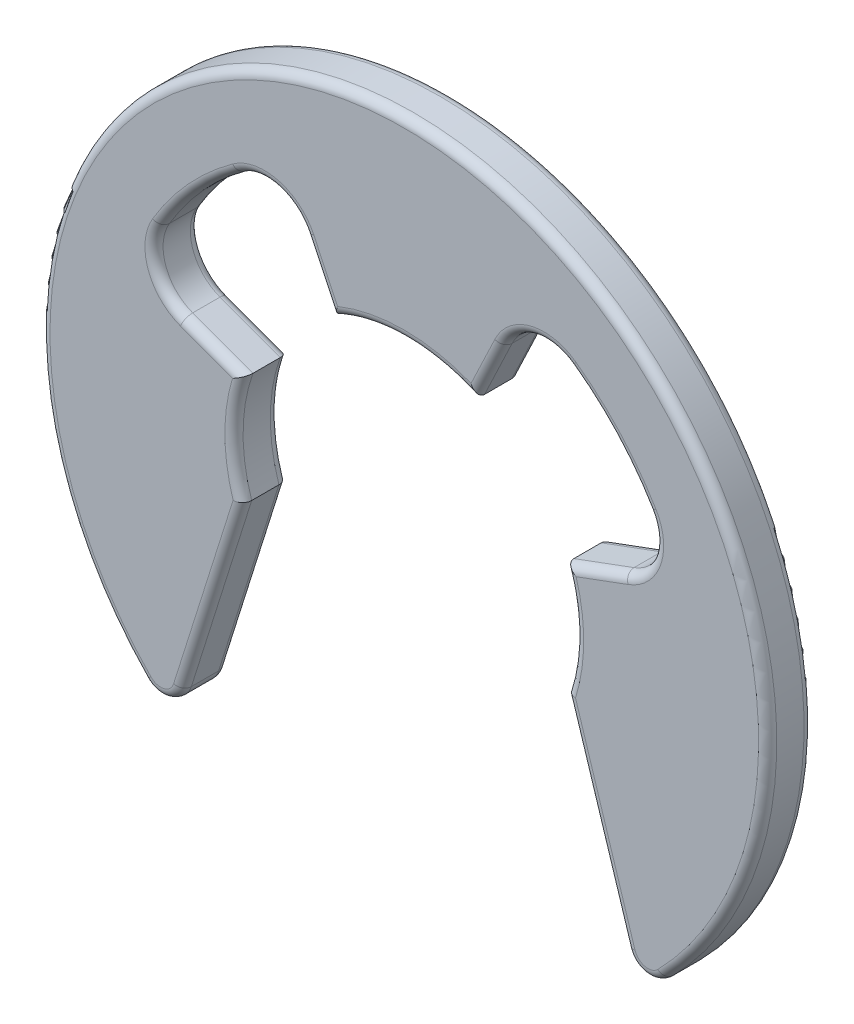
SolidWorks part; units mm, degrees
ref_plane "Face" through (0, 0, 0) normal (0, 0, 1) x (1, 0, 0)
ref_plane "Dessus" through (0, 0, 0) normal (0, 1, 0) x (1, 0, 0)
ref_plane "Droite" through (0, 0, 0) normal (1, 0, 0) x (0, 0, -1)
sketch "Esquisse1" plane through (0, 0, 0) normal (0, 0, 1) x (1, 0, 0)
  line L0 (0, 32.9901) -> (0, -36.8943) construction
  line L1 (1.5673, 3.4068) -> (2.1733, 4.683)
  line L2 (3.5324, 1.2588) -> (4.8573, 1.7492)
  line L3 (3.5596, -1.1798) -> (4.8875, -5.3919)
  line L4 (-3.5596, -1.1798) -> (-4.8875, -5.3919)
  line L5 (-3.5324, 1.2588) -> (-4.8573, 1.7492)
  line L6 (-1.5673, 3.4068) -> (-2.1733, 4.683)
  arc A0 (5.722, -5.591) -> (-5.722, -5.591) centre (0, 0) ccw
  arc A1 (3.5596, -1.1798) -> (3.5324, 1.2588) centre (0, 0) ccw
  arc A2 (5.3693, 3.1988) -> (3.6627, 5.0643) centre (0, 0) ccw
  arc A3 (1.5673, 3.4068) -> (-1.5673, 3.4068) centre (0, 0) ccw
  arc A4 (2.1733, 4.683) -> (3.6627, 5.0643) centre (3.0767, 4.254) cw
  arc A5 (5.3693, 3.1988) -> (4.8573, 1.7492) centre (4.5103, 2.687) cw
  arc A6 (4.8875, -5.3919) -> (5.722, -5.591) centre (5.3644, -5.2415) ccw
  arc A7 (-4.8875, -5.3919) -> (-5.722, -5.591) centre (-5.3644, -5.2415) cw
  arc A8 (-5.3693, 3.1988) -> (-4.8573, 1.7492) centre (-4.5103, 2.687) ccw
  arc A9 (-2.1733, 4.683) -> (-3.6627, 5.0643) centre (-3.0767, 4.254) ccw
  arc A10 (-5.3693, 3.1988) -> (-3.6627, 5.0643) centre (0, 0) cw
  arc A11 (-3.5596, -1.1798) -> (-3.5324, 1.2588) centre (0, 0) cw
  dimension "D1" = 16
  dimension "D2" = 7.5
  dimension "D3" = 12.5
  dimension "D4" = 1
  dimension "D5" = 0.5
extrude "Extrusion1" add sketch "Esquisse1" along normal blind 1
fillet "Congé1" radius 0.2
